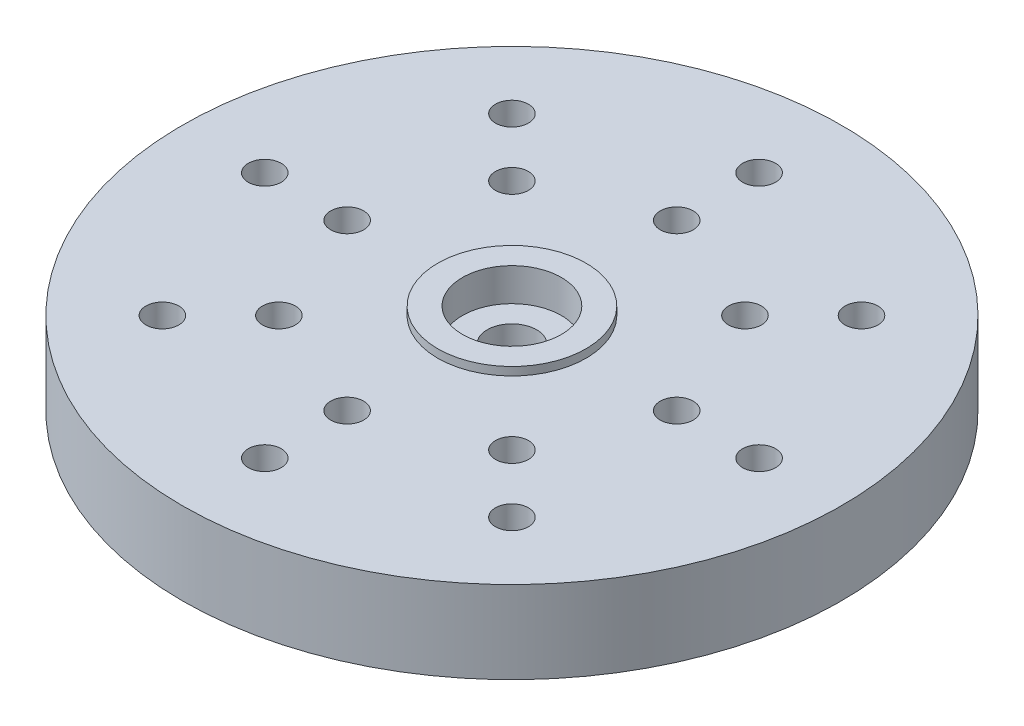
SolidWorks part; units mm, degrees
ref_plane "Front Plane" through (0, 0, 0) normal (0, 0, 1) x (1, 0, 0)
ref_plane "Top Plane" through (0, 0, 0) normal (0, 1, 0) x (1, 0, 0)
ref_plane "Right Plane" through (0, 0, 0) normal (1, 0, 0) x (0, 0, -1)
sketch "Sketch1" plane through (0, 0, 0) normal (0, 1, 0) x (1, 0, 0)
  circle A0 centre (0, 0) radius 20
  dimension "D1" = 40
extrude "Boss-Extrude1" add sketch "Sketch1" along normal blind 5
sketch "Sketch3" plane through (0, 5, 0) normal (0, 1, 0) x (1, 0, 0)
  circle A0 centre (0, 15) radius 1
  circle A1 centre (0, 10) radius 1
  dimension "D1" = 5
  dimension "D2" = 10
  dimension "D3" = 2
  dimension "D4" = 2
extrude "Cut-Extrude2" cut sketch "Sketch3" against normal blind 10
pattern_circular "CirPattern1" count 8 over 360 about axis through (0, 0, 0) along (0, 1, 0) of "Cut-Extrude2"
sketch "Sketch5" plane through (0, 0, 0) normal (0, -1, 0) x (1, 0, 0)
  circle A0 centre (0, 0) radius 6
  dimension "D1" = 12
extrude "Boss-Extrude3" add sketch "Sketch5" along normal blind 3
sketch "Sketch8" plane through (0, -3, 0) normal (0, -1, 0) x (1, 0, 0)
  line L0 (0, 3.75) -> (0, 3.05) construction
  line L1 (0, 3.05) -> (0.7, 3.6841)
  line L2 (0, 3.05) -> (-0.7, 3.6841)
  line L3 (1.2405, 2.7863) -> (2.1379, 3.0809)
  line L4 (1.2405, 2.7863) -> (0.859, 3.6503)
  line L5 (2.2666, 2.0408) -> (3.2062, 1.9449)
  line L6 (2.2666, 2.0408) -> (2.2694, 2.9853)
  line L7 (2.9007, 0.9425) -> (3.7201, 0.4727)
  line L8 (2.9007, 0.9425) -> (3.2875, 1.8042)
  line L9 (3.0333, -0.3188) -> (3.5907, -1.0813)
  line L10 (3.0333, -0.3188) -> (3.7371, 0.3111)
  line L11 (2.6414, -1.525) -> (2.8405, -2.4483)
  line L12 (2.6414, -1.525) -> (3.5405, -1.2358)
  line L13 (1.7927, -2.4675) -> (1.5991, -3.3919)
  line L14 (1.7927, -2.4675) -> (2.7318, -2.569)
  line L15 (0.6341, -2.9834) -> (0.0813, -3.7491)
  line L16 (0.6341, -2.9834) -> (1.4507, -3.458)
  line L17 (-0.6341, -2.9834) -> (-1.4507, -3.458)
  line L18 (-0.6341, -2.9834) -> (-0.0813, -3.7491)
  line L19 (-1.7927, -2.4675) -> (-2.7318, -2.569)
  line L20 (-1.7927, -2.4675) -> (-1.5991, -3.3919)
  line L21 (-2.6414, -1.525) -> (-3.5405, -1.2358)
  line L22 (-2.6414, -1.525) -> (-2.8405, -2.4483)
  line L23 (-3.0333, -0.3188) -> (-3.7371, 0.3111)
  line L24 (-3.0333, -0.3188) -> (-3.5907, -1.0813)
  line L25 (-2.9007, 0.9425) -> (-3.2875, 1.8042)
  line L26 (-2.9007, 0.9425) -> (-3.7201, 0.4727)
  line L27 (-2.2666, 2.0408) -> (-2.2694, 2.9853)
  line L28 (-2.2666, 2.0408) -> (-3.2062, 1.9449)
  line L29 (-1.2405, 2.7863) -> (-0.859, 3.6503)
  line L30 (-1.2405, 2.7863) -> (-2.1379, 3.0809)
  circle A0 centre (0, 0) radius 3.75 construction
  arc A1 (-0.7, 3.6841) -> (0.7, 3.6841) centre (0, 0) cw construction
  arc A2 (0.7, 3.6841) -> (0.9, 3.6404) centre (0, 0) cw
  arc A3 (2.1379, 3.0809) -> (2.3029, 2.9596) centre (0, 0) cw
  arc A4 (3.2062, 1.9449) -> (3.3076, 1.7671) centre (0, 0) cw
  arc A5 (3.7201, 0.4727) -> (3.7403, 0.269) centre (0, 0) cw
  arc A6 (3.5907, -1.0813) -> (3.5264, -1.2756) centre (0, 0) cw
  arc A7 (2.8405, -2.4483) -> (2.7027, -2.5996) centre (0, 0) cw
  arc A8 (1.5991, -3.3919) -> (1.4117, -3.4742) centre (0, 0) cw
  arc A9 (0.0813, -3.7491) -> (-0.1235, -3.748) centre (0, 0) cw
  arc A10 (-1.4507, -3.458) -> (-1.6372, -3.3737) centre (0, 0) cw
  arc A11 (-2.7318, -2.569) -> (-2.8679, -2.4161) centre (0, 0) cw
  arc A12 (-3.5405, -1.2358) -> (-3.6027, -1.0408) centre (0, 0) cw
  arc A13 (-3.7371, 0.3111) -> (-3.7145, 0.5145) centre (0, 0) cw
  arc A14 (-3.2875, 1.8042) -> (-3.1841, 1.9809) centre (0, 0) cw
  arc A15 (-2.2694, 2.9853) -> (-2.1031, 3.1047) centre (0, 0) cw
  arc A16 (-0.859, 3.6503) -> (-0.6585, 3.6917) centre (0, 0) cw
  point P64 (0, 0)
extrude "Cut-Extrude5" cut sketch "Sketch8" against normal through all contours A16 L29 L30 A15 L27 L28 A14 L25 L26 A13 L23 L24 A12 L21 L22 A11 L19 L20 A10 L17 L18 A9 L15 L16 A8 L13 L14 A7 L11 L12 A6 L9 L10 A5 L7 L8 A4 L5 L6 A3 L3 L4 A2 L1 L2
sketch "Sketch4" plane through (0, 5, 0) normal (0, 1, 0) x (1, 0, 0)
  circle A0 centre (0, 0) radius 4.5
  dimension "D1" = 9
extrude "Boss-Extrude4" add sketch "Sketch4" along normal blind 0.5 and the other way blind 4.96
sketch "Sketch10" plane through (0, 5.5, 0) normal (0, 1, 0) x (1, 0, 0)
  circle A0 centre (0, 0) radius 3
  dimension "D1" = 6
extrude "Cut-Extrude6" cut sketch "Sketch10" against normal blind 2
sketch "Sketch11" plane through (0, 3.5, 0) normal (0, 1, 0) x (1, 0, 0)
  circle A0 centre (0, 0) radius 1.5
  dimension "D1" = 3
extrude "Cut-Extrude7" cut sketch "Sketch11" against normal through all
